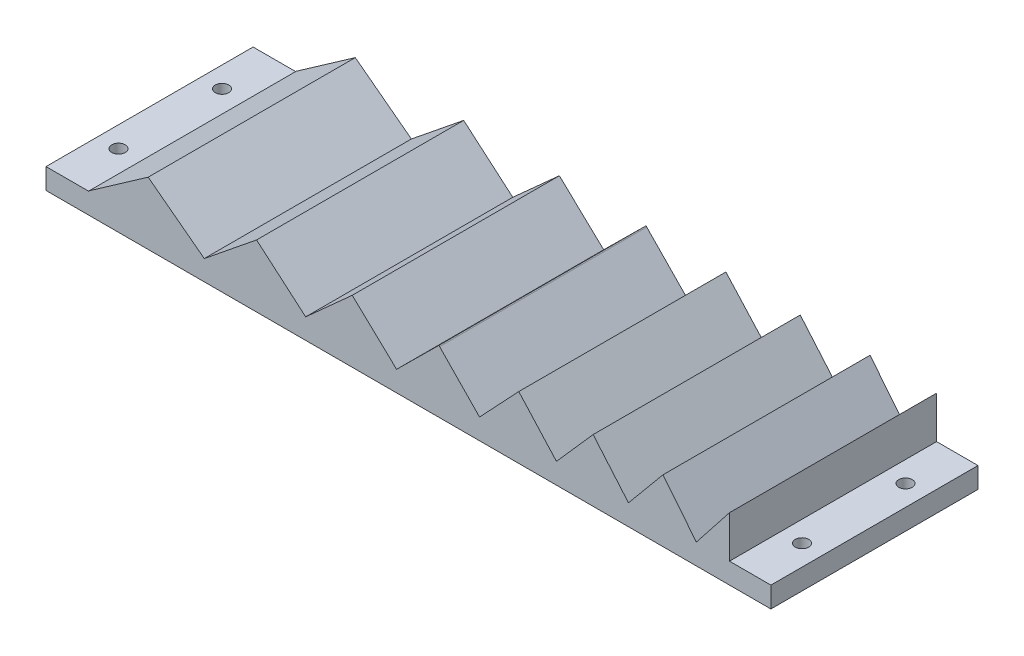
SolidWorks part; units mm, degrees
ref_plane "Front Plane" through (0, 0, 0) normal (0, 0, 1) x (1, 0, 0)
ref_plane "Top Plane" through (0, 0, 0) normal (0, 1, 0) x (1, 0, 0)
ref_plane "Right Plane" through (0, 0, 0) normal (1, 0, 0) x (0, 0, -1)
sketch "Model" plane through (0, 0, 0) normal (0, 0, 1) x (1, 0, 0)
  line L0 (57.0611, 0.2658) -> (81.1349, 19.7252)
  line L1 (81.1349, 19.7252) -> (81.666, 20.1545)
  line L2 (81.666, 20.1545) -> (105.3807, -0.146)
  line L3 (169.3373, 19.7283) -> (169.7046, 20.0919)
  line L4 (149.2853, -0.1516) -> (148.8489, 0.2611)
  line L5 (105.3807, -0.146) -> (127.8633, 20.1105)
  line L6 (148.8489, 0.2611) -> (127.8633, 20.1105)
  line L7 (149.6685, 0.2535) -> (149.2853, -0.1516)
  line L8 (29.3358, 20.2397) -> (0.8204, 0.2736)
  line L9 (56.4236, -0.2494) -> (55.7293, 0.2757)
  line L10 (57.0611, 0.2658) -> (56.4236, -0.2494)
  line L11 (170.0544, 19.7386) -> (169.7046, 20.0919)
  line L12 (189.0062, 0.2574) -> (189.3245, -0.0698)
  line L13 (189.6208, 0.2452) -> (189.3245, -0.0698)
  line L14 (207.9579, 19.7338) -> (208.2732, 20.0689)
  line L15 (208.5726, 19.7378) -> (208.2732, 20.0689)
  line L16 (226.1926, 0.2555) -> (226.4574, -0.0373)
  line L17 (226.7048, 0.243) -> (226.4574, -0.0373)
  line L18 (243.915, 19.7378) -> (244.1766, 20.0341)
  line L19 (244.4272, 19.7398) -> (244.1766, 20.0341)
  line L20 (261.0228, 0.2512) -> (261.2343, 0.0028)
  line L21 (261.4326, 0.2415) -> (261.2343, 0.0028)
  line L22 (277.6184, 19.7331) -> (277.8684, 20.0341)
  line L23 (278.1306, 19.7408) -> (277.882, 20.05)
  line L24 (277.882, 20.05) -> (277.8684, 20.0341)
  line L25 (293.8042, 0.2534) -> (294.016, -0.01)
  line L26 (294.214, 0.2412) -> (294.016, -0.01)
  line L27 (0, 0) -> (-20, 0)
  line L28 (-20, 0) -> (-20, -10)
  line L29 (-20, -10) -> (330, -10)
  line L30 (330, -10) -> (330, 0)
  line L31 (330, 0) -> (310, 0)
  line L32 (310, 0) -> (310, 20.268)
  line L33 (309.5802, 19.7354) -> (310, 20.268)
  line L34 (0, 0) -> (0.8204, 0)
  line L35 (0.8204, 0) -> (0.8204, 0.2736)
  line L76 (149.6685, 0.2535) -> (169.3373, 19.7283)
  line L84 (170.0544, 19.7386) -> (189.0062, 0.2574)
  line L91 (189.6208, 0.2452) -> (207.9579, 19.7338)
  line L98 (208.5726, 19.7378) -> (226.1926, 0.2555)
  line L104 (226.7048, 0.243) -> (243.915, 19.7378)
  line L110 (244.4272, 19.7398) -> (261.0228, 0.2512)
  line L115 (261.4326, 0.2415) -> (277.6184, 19.7331)
  line L121 (278.1306, 19.7408) -> (293.8042, 0.2534)
  line L126 (294.214, 0.2412) -> (309.5802, 19.7354)
  line L132 (55.7293, 0.2757) -> (29.3358, 20.2397)
  point P1 (105.3807, -0.146)
  dimension "D1" = 10
  dimension "D2" = 20
  dimension "D3" = 350
extrude "Boss-Extrude1" add sketch "Model" along normal blind 100
sketch "Sketch2" plane through (0, -10, 0) normal (0, -1, 0) x (1, 0, 0)
  line L0 (-20, 50) -> (330, 50) construction
  line L1 (-20, 100) -> (-20, 0) construction
  line L2 (330, 100) -> (330, 0) construction
  line L4 (-20, 100) -> (330, 100) construction
  line L5 (155, 100) -> (155, 0) construction
  line L6 (-20, 0) -> (330, 0) construction
  circle A0 centre (-10, 75) radius 3.25
  circle A2 centre (-10, 25) radius 3.25
  circle A3 centre (320, 25) radius 3.25
  circle A4 centre (320, 75) radius 3.25
  dimension "D1" = 6.5
  dimension "D2" = 25
  dimension "D3" = 10
extrude "Cut-Extrude1" cut sketch "Sketch2" against normal through all both and the other way through all
